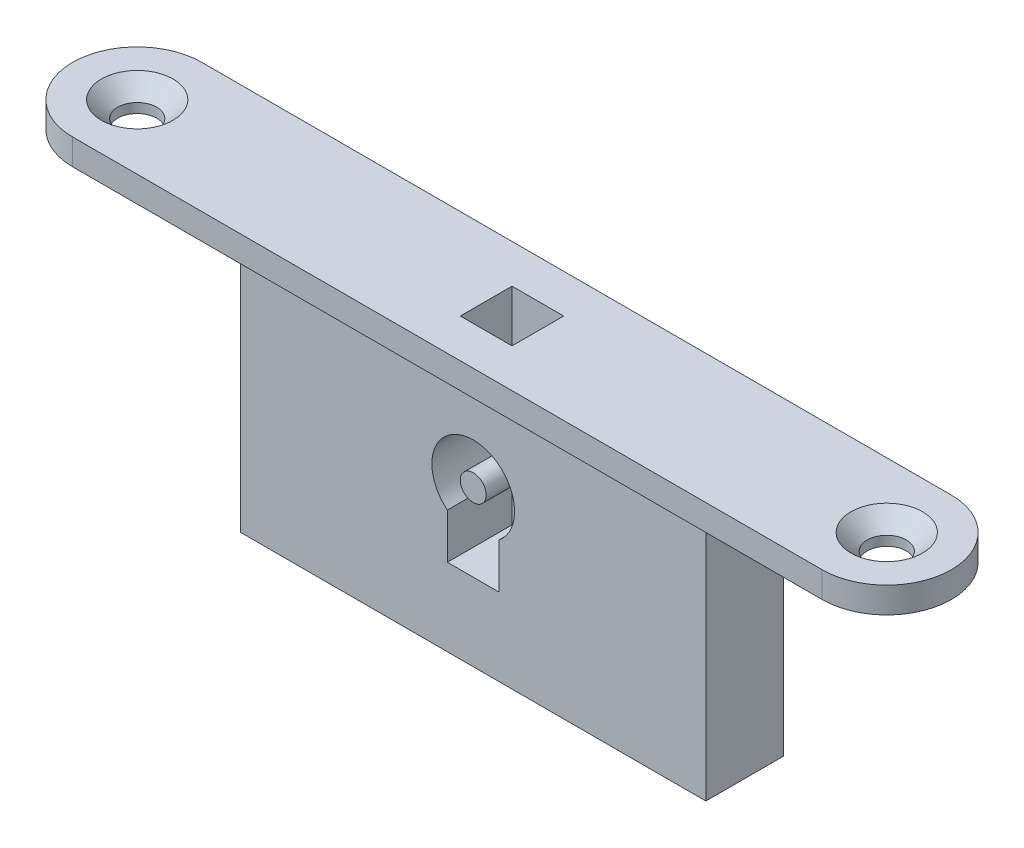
SolidWorks part; units mm, degrees
ref_plane "Front Plane" through (0, 0, 0) normal (0, 0, 1) x (1, 0, 0)
ref_plane "Top Plane" through (0, 0, 0) normal (0, 1, 0) x (1, 0, 0)
ref_plane "Right Plane" through (0, 0, 0) normal (1, 0, 0) x (0, 0, -1)
sketch "Sketch1" plane through (0, 0, 0) normal (0, 1, 0) x (1, 0, 0)
  line L0 (-23.0188, 0) -> (23.0188, 0) construction
  line L1 (-23.0188, -3.9688) -> (23.0188, -3.9688)
  line L2 (-23.0188, 3.9688) -> (23.0188, 3.9688)
  arc A0 (-23.0188, -3.9688) -> (-23.0188, 3.9688) centre (-23.0188, 0) cw
  arc A1 (23.0188, -3.9688) -> (23.0188, 3.9688) centre (23.0188, 0) ccw
  dimension "D1" = 46.0375
  dimension "D2" = 7.9375
extrude "Extrude1" add sketch "Sketch1" against normal blind 1.5875
sketch "Sketch2" plane through (0, -1.5875, 0) normal (0, -1, 0) x (1, 0, 0)
  line L1 (-14.2875, 2.3812) -> (14.2875, 2.3812)
  line L2 (-14.2875, 2.3812) -> (-14.2875, -2.3813)
  line L3 (-14.2875, -2.3813) -> (14.2875, -2.3813)
  line L4 (14.2875, 2.3812) -> (14.2875, -2.3813)
  line L5 (-14.2875, 2.3812) -> (14.2875, -2.3813) construction
  line L6 (-14.2875, -2.3813) -> (14.2875, 2.3812) construction
  point P0 (0, 0)
  dimension "D1" = 28.575
  dimension "D2" = 4.7625
extrude "Extrude2" add sketch "Sketch2" along normal blind 15.875
sketch "Sketch4" plane through (0, 0, 0) normal (0, 1, 0) x (1, 0, 0)
  line L1 (-1.5875, 1.5875) -> (1.5875, 1.5875)
  line L2 (-1.5875, 1.5875) -> (-1.5875, -1.5875)
  line L3 (-1.5875, -1.5875) -> (1.5875, -1.5875)
  line L4 (1.5875, 1.5875) -> (1.5875, -1.5875)
  line L5 (-1.5875, 1.5875) -> (1.5875, -1.5875) construction
  line L6 (-1.5875, -1.5875) -> (1.5875, 1.5875) construction
  point P0 (0, 0)
  dimension "D1" = 3.175
extrude "Extrude4" cut sketch "Sketch4" against normal blind 6.35
sketch "Sketch3" plane through (0, 0, 2.3812) normal (0, 0, 1) x (1, 0, 0)
  line L0 (0, 0) -> (0, -17.4625) construction
  line L1 (14.2875, -17.4625) -> (-14.2875, -17.4625) construction
  line L2 (1.5875, -9.9203) -> (1.5875, -12.7)
  line L3 (1.5875, -12.7) -> (-1.5875, -12.7)
  line L4 (-1.5875, -9.9203) -> (-1.5875, -12.7)
  line L5 (-23.0188, 0) -> (23.0188, 0) construction
  arc A0 (1.5875, -9.9203) -> (-1.5875, -9.9203) centre (0, -7.9375) ccw
  point P11 (0, -12.7)
  dimension "D1" = 2.54
  dimension "D2" = 7.9375
  dimension "D3" = 3.175
  dimension "D4" = 4.7625
extrude "Extrude3" cut sketch "Sketch3" against normal up to surface (3.9688 mm away)
hole_wizard "CSK for M2 Flat Head Machine Screw1" positions "Sketch6" profile "Sketch5" countersink size "M2" standard "Ansi Metric"
sketch "Sketch6" plane through (0, 0, 0) normal (0, 1, 0) x (-1, 0, 0)
  point P0 (-23.0188, 0)
  point P1 (23.0188, 0)
sketch "Sketch5" plane through (23.0188, 0, 0) normal (1, 0, 0) x (0, 0, 1)
  line L0 (0, 0) -> (0, 17.4625)
  line L1 (0, 17.4625) -> (1.2, 17.4625)
  line L2 (1.2, 17.4625) -> (1.2, 1)
  line L3 (1.2, 1) -> (2.2, 0)
  line L5 (2.2, 0) -> (0, 0)
  line L6 (-1.2, 1) -> (-2.2, 0) construction
  line L11 (0, -6.35) -> (0, 107.95) construction
  dimension "Thru Hole Dia." = 2.4
  dimension "Thru Hole Depth" = 17.4625
  dimension "Near C'Sink Dia." = 4.4
  dimension "Near C'Sink Angle" = 90
sketch "Sketch7" plane through (0, 0, -1.5875) normal (0, 0, 1) x (1, 0, 0)
  circle A0 centre (0, -7.9375) radius 0.7938
  dimension "D1" = 1.5875
extrude "Extrude5" add sketch "Sketch7" along normal up to surface (3.9688 mm away)
